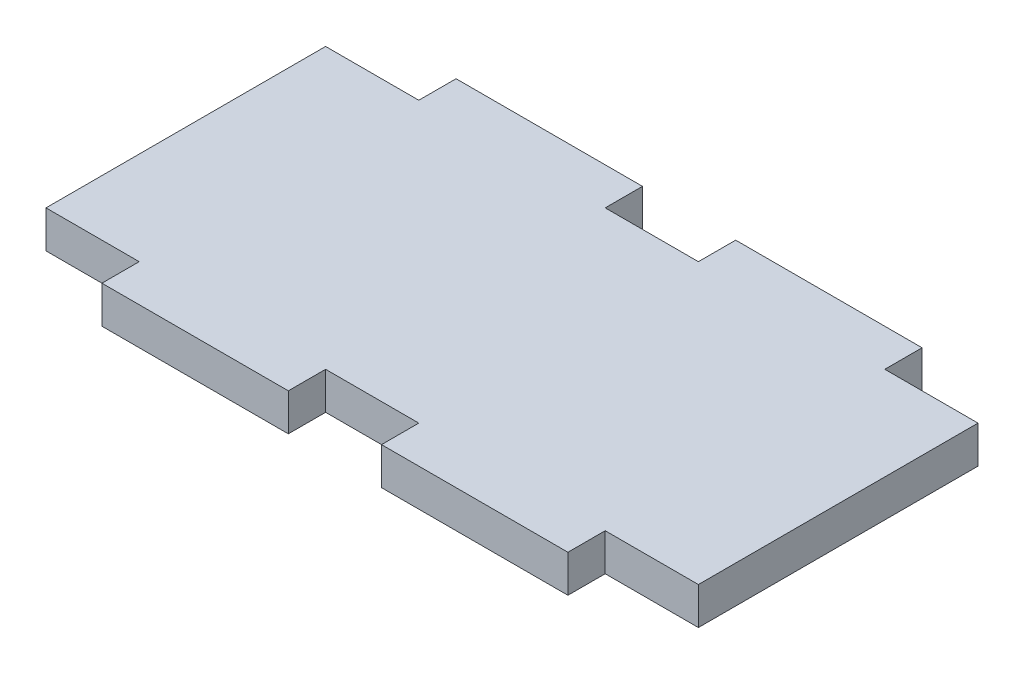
SolidWorks part; units mm, degrees
ref_plane "Front Plane" through (0, 0, 0) normal (0, 0, 1) x (1, 0, 0)
ref_plane "Top Plane" through (0, 0, 0) normal (0, 1, 0) x (1, 0, 0)
ref_plane "Right Plane" through (0, 0, 0) normal (1, 0, 0) x (0, 0, -1)
sketch "Sketch1" plane through (0, 0, 0) normal (0, 1, 0) x (1, 0, 0)
  line L1 (0, 0) -> (35, 0)
  line L2 (0, 0) -> (0, 15)
  line L3 (0, 15) -> (35, 15)
  line L4 (35, 0) -> (35, 15)
  dimension "D1" = 15
  dimension "D2" = 35
extrude "Boss-Extrude1" add sketch "Sketch1" along normal blind 2
sketch "Sketch2" plane through (0, 0, 0) normal (0, 0, 1) x (1, 0, 0)
  line L0 (0, 2) -> (35, 2) construction
  line L1 (5, 2) -> (15, 2)
  line L2 (5, 2) -> (5, 0)
  line L3 (5, 0) -> (15, 0)
  line L4 (15, 2) -> (15, 0)
  line L5 (0, 0) -> (35, 0) construction
  dimension "D1" = 5
  dimension "D2" = 10
extrude "Boss-Extrude2" add sketch "Sketch2" along normal blind 2
pattern_linear "LPattern1" count 2 spacing 15 along (1, 0, 0) of "Boss-Extrude2"
sketch "Sketch3" plane through (0, 0, -15) normal (0, 0, -1) x (-1, 0, 0)
  line L0 (-20, 2) -> (-20, 0) construction
  line L1 (-20, 0) -> (-30, 0) construction
  line L2 (-30, 0) -> (-30, 2) construction
  line L3 (-30, 2) -> (-20, 2) construction
  line L4 (-5, 2) -> (-5, 0) construction
  line L5 (-5, 0) -> (-15, 0) construction
  line L6 (-15, 0) -> (-15, 2) construction
  line L7 (-15, 2) -> (-5, 2) construction
  line L8 (-20, 2) -> (-20, 0)
  line L9 (-20, 0) -> (-30, 0)
  line L10 (-30, 0) -> (-30, 2)
  line L11 (-30, 2) -> (-20, 2)
  line L12 (-5, 2) -> (-5, 0)
  line L13 (-5, 0) -> (-15, 0)
  line L14 (-15, 0) -> (-15, 2)
  line L15 (-15, 2) -> (-5, 2)
extrude "Boss-Extrude3" add sketch "Sketch3" along normal blind 2
equation "\"anch\" = 2"
equation "\"alt\" = 100"
equation "\"pilanch\" = 100"
equation "\"pilalt\" = 250"
equation "\"bodyHeigh\" = 60"
equation "\"dorsalFinHeigh\" = 400"
equation "\"D1@Boss-Extrude1\"=\"anch\""
equation "\"D1@Boss-Extrude2\"=\"anch\""
equation "\"D1@Boss-Extrude3\"=\"anch\""
